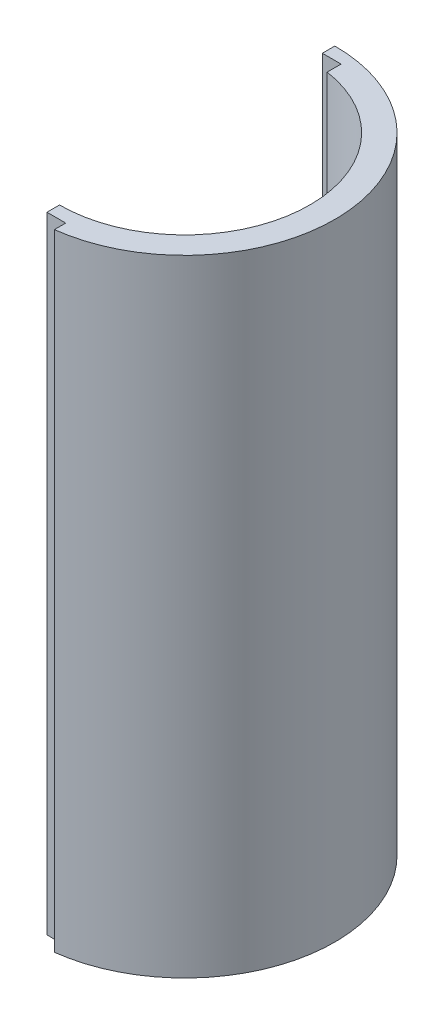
SolidWorks part; units mm, degrees
ref_plane "Front Plane" through (0, 0, 0) normal (0, 0, 1) x (1, 0, 0)
ref_plane "Top Plane" through (0, 0, 0) normal (0, 1, 0) x (1, 0, 0)
ref_plane "Right Plane" through (0, 0, 0) normal (1, 0, 0) x (0, 0, -1)
sketch "Sketch1" plane through (0, 0, 0) normal (0, 1, 0) x (1, 0, 0)
  line L0 (0, 0) -> (0, 12) construction
  line L1 (0, 10) -> (0, 12)
  line L2 (0, -10) -> (0, -12)
  circle A0 centre (0, 0) radius 10 construction
  circle A1 centre (0, 0) radius 12 construction
  arc A2 (0, 10) -> (0, -10) centre (0, 0) cw
  arc A3 (0, -12) -> (0, 12) centre (0, 0) ccw
  dimension "D1" = 2
extrude "Boss-Extrude1" add sketch "Sketch1" along normal blind 50
sketch "Sketch2" plane through (0, 0, 0) normal (0, 1, 0) x (1, 0, 0)
  line L0 (0, 10) -> (0, 12) construction
  line L1 (0, 11) -> (1.4995, 11)
  line L2 (0, 11) -> (0, 8.8772)
  line L3 (0, 8.8772) -> (1.4995, 8.8772)
  line L4 (1.4995, 11) -> (1.4995, 8.8772)
  line L5 (0, -10) -> (0, -12) construction
  line L6 (0, -11) -> (1.4995, -11)
  line L7 (0, -11) -> (0, -13.7511)
  line L8 (0, -13.7511) -> (1.4995, -13.7511)
  line L9 (1.4995, -11) -> (1.4995, -13.7511)
extrude "Cut-Extrude1" cut sketch "Sketch2" along normal blind 60
